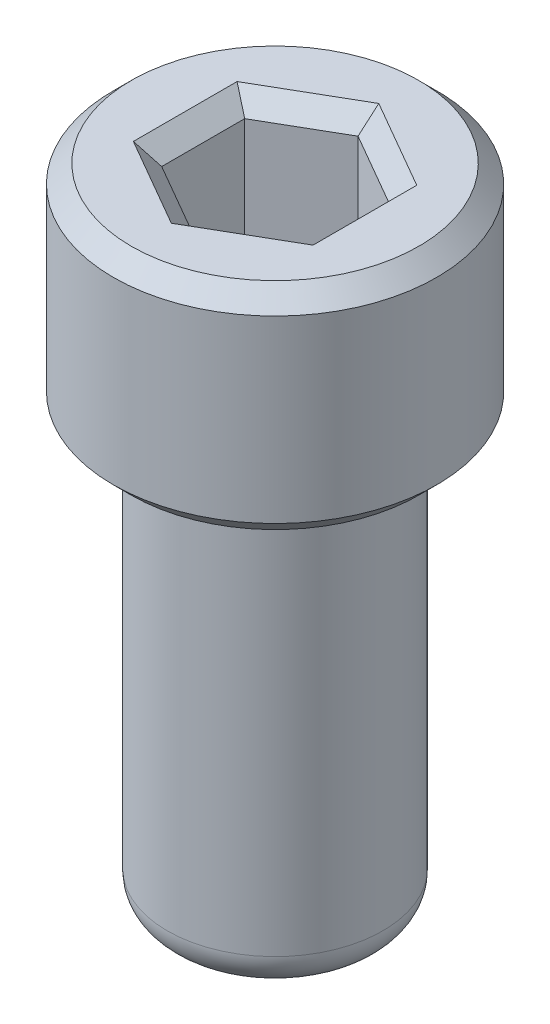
SolidWorks part; units mm, degrees
ref_plane "Front Plane" through (0, 0, 0) normal (0, 0, 1) x (1, 0, 0)
ref_plane "Top Plane" through (0, 0, 0) normal (0, 1, 0) x (1, 0, 0)
ref_plane "Right Plane" through (0, 0, 0) normal (1, 0, 0) x (0, 0, -1)
sketch "Sketch1" plane through (0, 0, 0) normal (0, 1, 0) x (1, 0, 0)
  circle A0 centre (0, 0) radius 1.5
  dimension "D1" = 3
extrude "Boss-Extrude1" add sketch "Sketch1" along normal blind 6
sketch "Sketch2" plane through (0, 6, 0) normal (0, 1, 0) x (1, 0, 0)
  circle A0 centre (0, 0) radius 2.25
  dimension "D1" = 4.5
extrude "Boss-Extrude2" add sketch "Sketch2" along normal blind 3
sketch "Sketch3" plane through (0, 9, 0) normal (0, 1, 0) x (1, 0, 0)
  line L1 (0, 1.1547) -> (-1, 0.5774)
  line L2 (-1, 0.5774) -> (-1, -0.5774)
  line L3 (-1, -0.5774) -> (0, -1.1547)
  line L4 (0, -1.1547) -> (1, -0.5774)
  line L5 (1, -0.5774) -> (1, 0.5774)
  line L6 (1, 0.5774) -> (0, 1.1547)
  circle A0 centre (0, 0) radius 1 construction
extrude "Cut-Extrude1" cut sketch "Sketch3" against normal blind 2
chamfer "Chamfer1" distance 0.25 angle 45 8 edges at (0, 6, 2.25) (0, 9, 2.25) (-0.5, 9, 0.866) (-1, 9, 0) (-0.5, 9, -0.866) (0.5, 9, -0.866) (1, 9, 0) (0.5, 9, 0.866)
fillet "Fillet1" radius 0.5 1 edges at (0, 0, 1.5)
